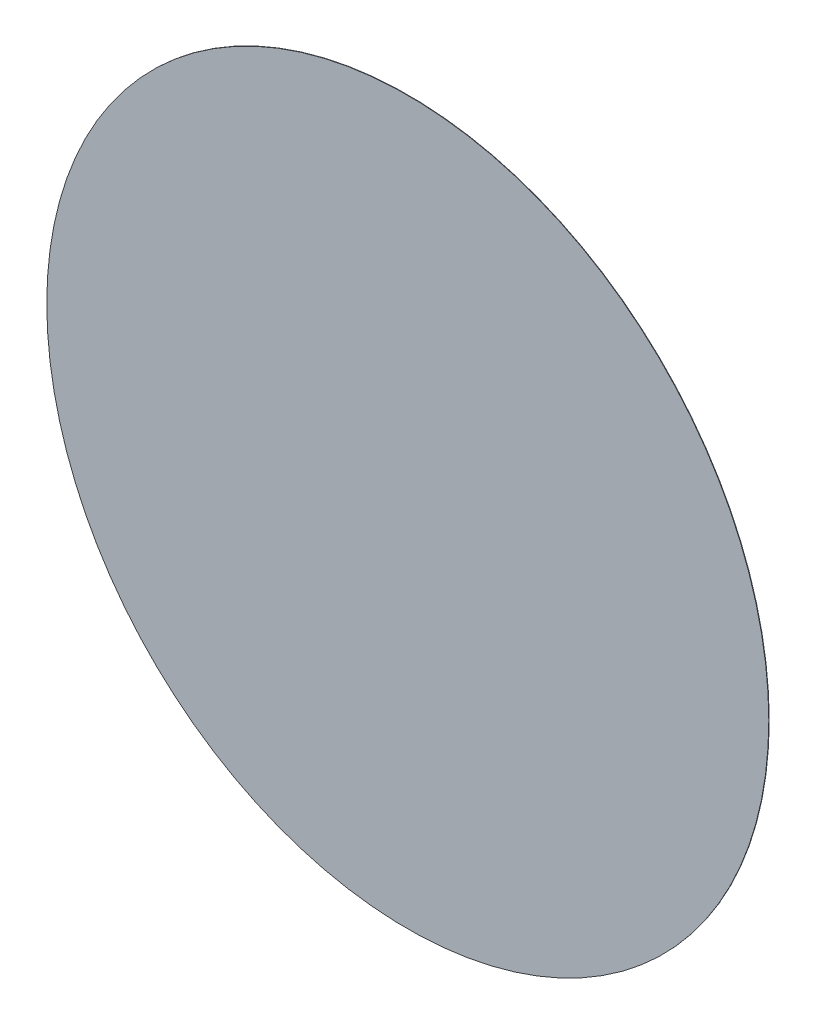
SolidWorks part; units mm, degrees
ref_plane "Front" through (0, 0, 0) normal (0, 0, 1) x (1, 0, 0)
ref_plane "Top" through (0, 0, 0) normal (0, 1, 0) x (1, 0, 0)
ref_plane "Right" through (0, 0, 0) normal (1, 0, 0) x (0, 0, -1)
sketch "Sketch1" plane through (0, 0, 0) normal (0, 0, 1) x (1, 0, 0)
  circle A0 centre (0, 0) radius 12.5
  dimension "D1" = 25
extrude "Extrude1" add sketch "Sketch1" along normal blind 0.015
